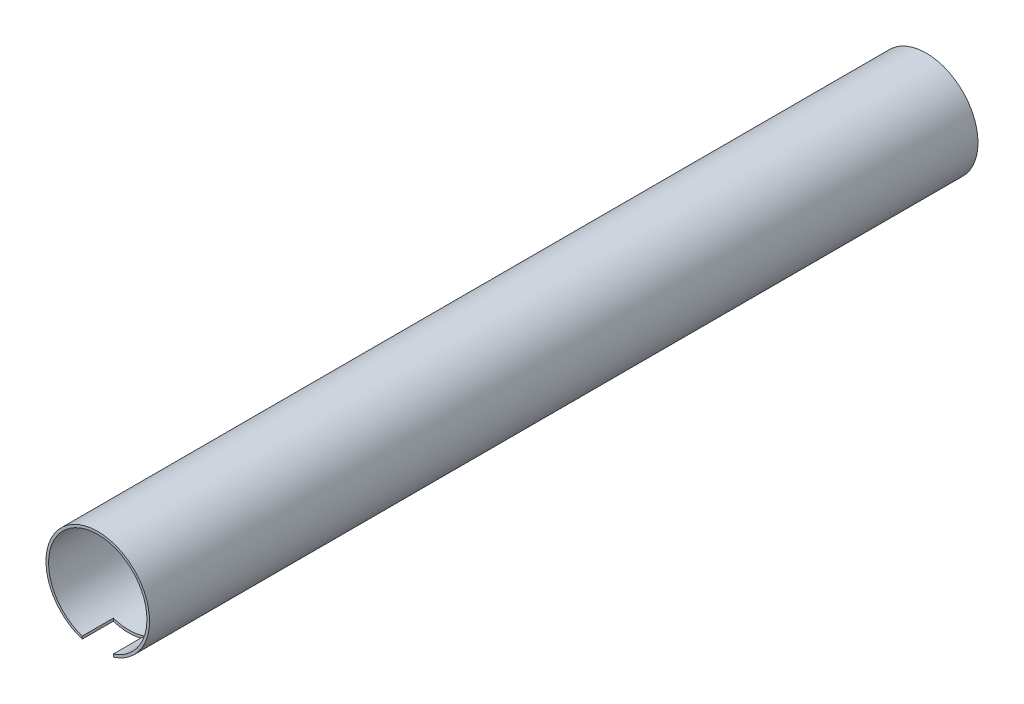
SolidWorks part; units mm, degrees
ref_plane "Plan de face" through (0, 0, 0) normal (0, 0, 1) x (1, 0, 0)
ref_plane "Plan de dessus" through (0, 0, 0) normal (0, 1, 0) x (1, 0, 0)
ref_plane "Plan de droite" through (0, 0, 0) normal (1, 0, 0) x (0, 0, -1)
sketch "Esquisse1" plane through (0, 0, 0) normal (0, 0, 1) x (1, 0, 0)
  circle A0 centre (0, 0) radius 47.5
  circle A1 centre (0, 0) radius 50
  dimension "D1" = 95
  dimension "D2" = 100
extrude "Boss.-Extru.1" add sketch "Esquisse1" along normal blind 800
sketch "Esquisse2" plane through (0, 0, 0) normal (0, 1, 0) x (1, 0, 0)
  line L0 (0, -800) -> (0, -719.9295) construction
  line L1 (-50, -800) -> (50, -800) construction
  line L3 (-15, -800) -> (15, -800)
  line L4 (-15, -800) -> (-15, -770)
  line L5 (-15, -770) -> (15, -770)
  line L6 (15, -800) -> (15, -770)
  dimension "D1" = 30
  dimension "D2" = 30
extrude "Enlèv. mat.-Extru.1" cut sketch "Esquisse2" against normal blind 800
